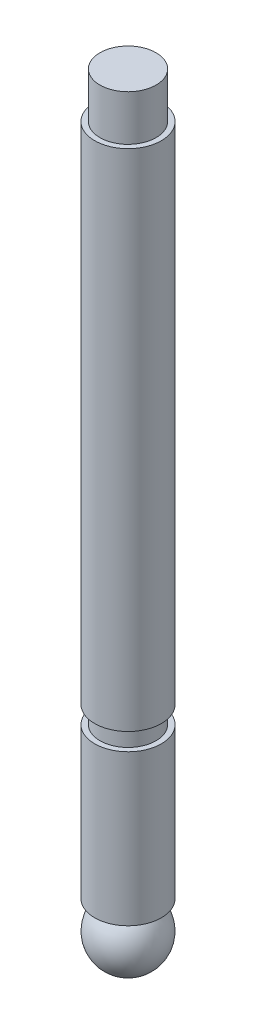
SolidWorks part; units mm, degrees
ref_plane "Front Plane" through (0, 0, 0) normal (0, 0, 1) x (1, 0, 0)
ref_plane "Top Plane" through (0, 0, 0) normal (0, 1, 0) x (1, 0, 0)
ref_plane "Right Plane" through (0, 0, 0) normal (1, 0, 0) x (0, 0, -1)
sketch "Sketch1" plane through (0, 0, 0) normal (0, 0, 1) x (1, 0, 0)
  line L0 (0, 0) -> (0, 32144.2635) construction
  line L2 (9.5, 0) -> (9.5, 43)
  line L3 (9.5, 43) -> (8, 43)
  line L4 (8, 43) -> (8, 48)
  line L5 (8, 48) -> (9.5, 48)
  line L6 (9.5, 48) -> (9.5, 192)
  line L7 (9.5, 192) -> (8, 192)
  line L8 (8, 192) -> (8, 205)
  line L9 (8, 205) -> (0, 205)
  line L10 (0, -17.5) -> (0, 205)
  line L12 (9.5, 0) -> (5.1235, 0)
  arc A1 (5.1235, 0) -> (0, -17.5) centre (0, -8) cw
  point P15 (8, 45.5)
  dimension "D4" = 9.5
  dimension "D1" = 13
  dimension "D2" = 8
  dimension "D3" = 1.5
  dimension "D5" = 9.5
  dimension "D6" = 0
  dimension "D7" = 5
  dimension "D8" = 43
  dimension "D9" = 205
  dimension "D10" = 8
revolve "Revolve2" add sketch "Sketch1" angle 360 about L0
